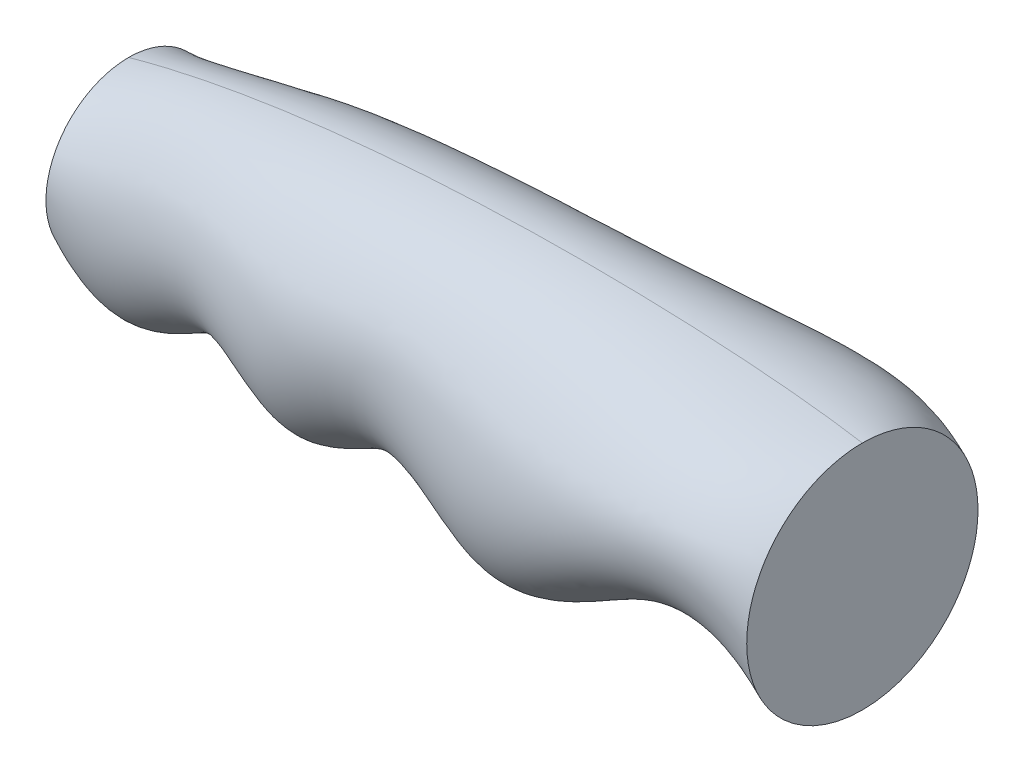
SolidWorks part; units mm, degrees
ref_plane "Vorn" through (0, 0, 0) normal (0, 0, 1) x (1, 0, 0)
ref_plane "Oben" through (0, 0, 0) normal (0, 1, 0) x (1, 0, 0)
ref_plane "Rechts" through (0, 0, 0) normal (1, 0, 0) x (0, 0, -1)
sketch "Skizze1" plane through (0, 0, 0) normal (0, 0, 1) x (1, 0, 0)
  line L0 (0, 23.6376) -> (0, 45.082)
  line L1 (0, 23.6376) -> (400, 23.6376)
  line L2 (400, 23.6376) -> (400, 63.043)
  spline S0 degree 3 poles (0, 45.082) (126.7853, 80.8009) (319.3578, 76.7125) (400, 63.043) knots 0 0 0 0 1 1 1 1
  dimension "D1" = 400
sketch "Skizze3" plane through (0, 0, 0) normal (1, 0, 0) x (0, 0, -1)
  arc A0 (0, 45.082) -> (0, -45.082) centre (0, 0) ccw
ref_plane "Ebene1" through (400, 0, 0) normal (1, 0, 0) x (0, 0, -1)
sketch "Skizze4" plane through (400, 0, 0) normal (1, 0, 0) x (0, 0, -1)
  arc A0 (0, 63.043) -> (0, -63.043) centre (0, 0) ccw
sketch "Skizze2" plane through (0, 0, 0) normal (0, 0, 1) x (1, 0, 0)
  line L0 (0, -17.1116) -> (0, -45.082)
  line L1 (400, -63.043) -> (400, 63.043) construction
  line L2 (400, -10.3503) -> (400, -63.043)
  line L3 (0, -17.1116) -> (400, -10.3503)
  spline S0 degree 3 poles (0, -45.082) (25.4438, -91.8123) (70.7802, -12.7781) (126.1444, -83.0883) (179.258, -28.1176) (263.6956, -127.9119) (343.1325, 21.5708) (400, -63.043) knots 0 0 0 0 0.212018 0.326901 0.449179 0.597876 1 1 1 1
curve "Kurve1"
curve "Kurve2"
loft "Ausformung1" add profiles "Skizze2", "Skizze1"
mirror "Spiegeln1" about plane through (217.3037, 72.5832, 0) normal (0, 0, 1)
